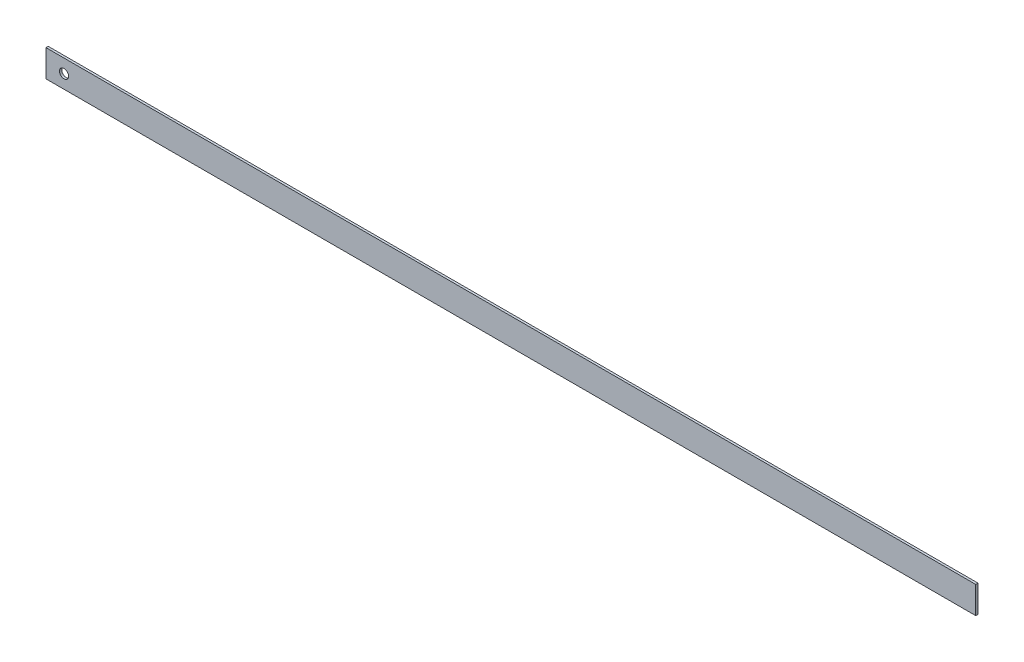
SolidWorks part; units mm, degrees
ref_plane "Front Plane" through (0, 0, 0) normal (0, 0, 1) x (1, 0, 0)
ref_plane "Top Plane" through (0, 0, 0) normal (0, 1, 0) x (1, 0, 0)
ref_plane "Right Plane" through (0, 0, 0) normal (1, 0, 0) x (0, 0, -1)
sketch "Sketch1" plane through (0, 0, 0) normal (0, 0, 1) x (1, 0, 0)
  line L0 (-654.05, 9.525) -> (-641.35, 9.525) construction
  line L1 (-654.05, 19.05) -> (0, 19.05)
  line L2 (-654.05, 19.05) -> (-654.05, 0)
  line L3 (-654.05, 0) -> (0, 0)
  line L4 (0, 19.05) -> (0, 0)
  circle A0 centre (-641.35, 9.525) radius 3.175
  circle A1 centre (-641.35, 9.525) radius 3.175 construction
  dimension "D3" = 6.35
  dimension "D5" = 6.35
  dimension "D6" = 12.7
  dimension "D1" = 19.05
  dimension "D2" = 654.05
  dimension "D4" = 12.7
extrude "Boss-Extrude1" add sketch "Sketch1" along normal blind 1.5875
